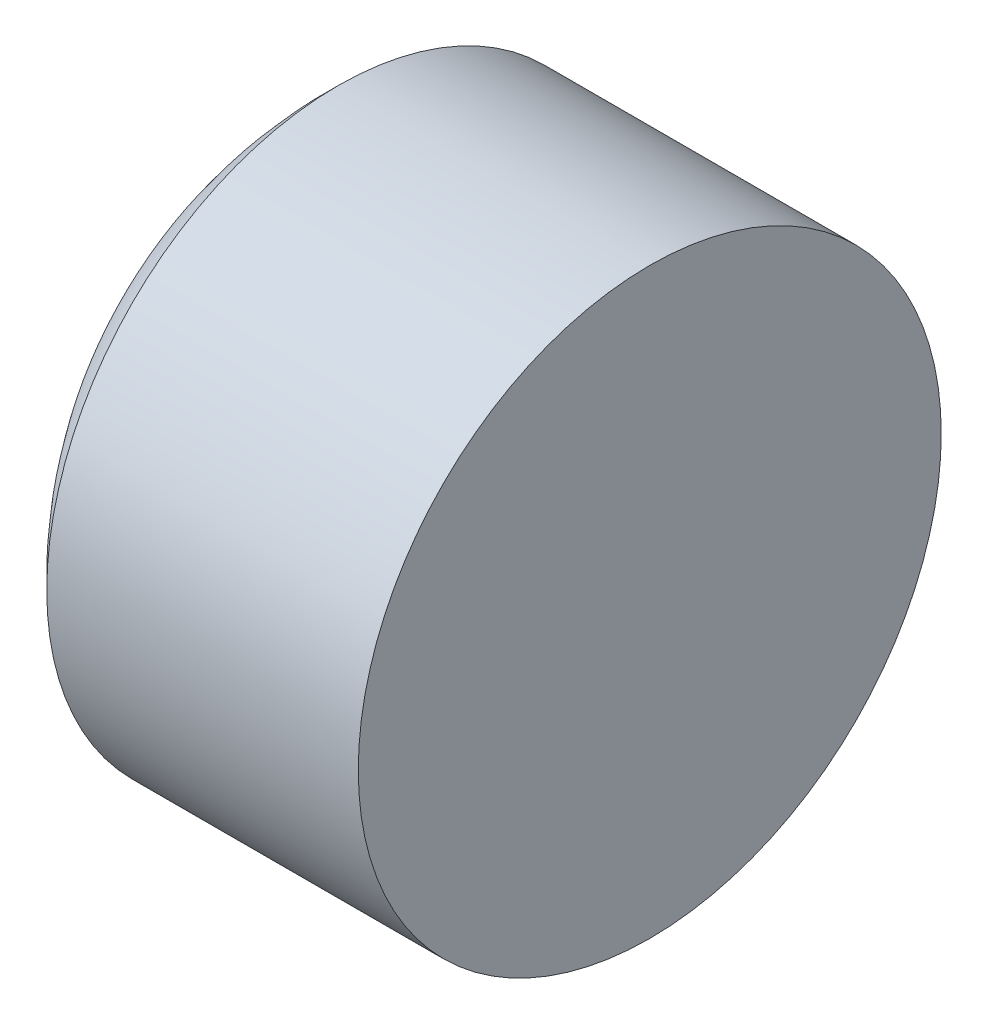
SolidWorks part; units mm, degrees
ref_plane "Front Plane" through (0, 0, 0) normal (0, 0, 1) x (1, 0, 0)
ref_plane "Top Plane" through (0, 0, 0) normal (0, 1, 0) x (1, 0, 0)
ref_plane "Right Plane" through (0, 0, 0) normal (1, 0, 0) x (0, 0, -1)
sketch "Sketch1" plane through (0, 0, 0) normal (0, 0, 1) x (1, 0, 0)
  line L0 (0, 0) -> (118.0759, 0) construction
  line L1 (-139.7, 0) -> (12.7, 0)
  line L2 (12.7, 0) -> (12.7, 101.6)
  line L3 (12.7, 101.6) -> (-95.8829, 101.6)
  arc A0 (-95.8829, 101.6) -> (-139.7, 0) centre (0, 0) ccw
  dimension "D1" = 139.7
  dimension "D2" = 203.2
  dimension "D3" = 12.7
revolve "Revolve1" add sketch "Sketch1" angle 360 about L0
